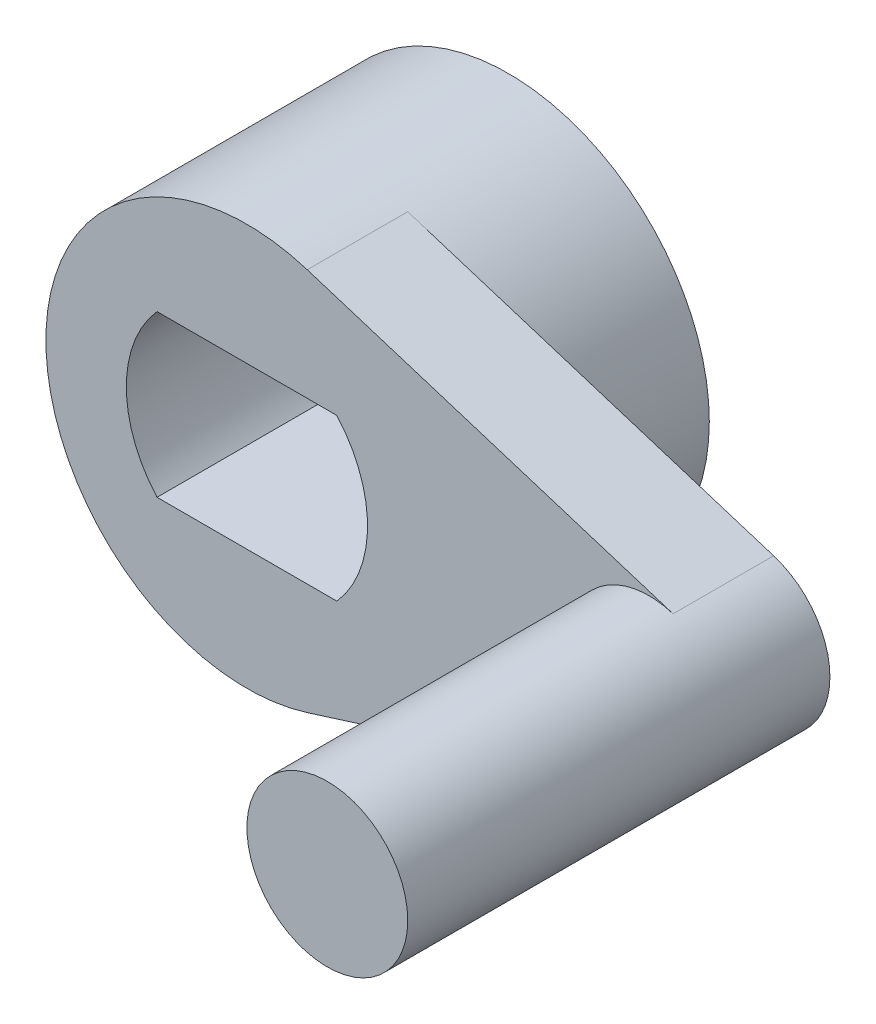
SolidWorks part; units mm, degrees
ref_plane "Face" through (0, 0, 0) normal (0, 0, 1) x (1, 0, 0)
ref_plane "Dessus" through (0, 0, 0) normal (0, 1, 0) x (1, 0, 0)
ref_plane "Droite" through (0, 0, 0) normal (1, 0, 0) x (0, 0, -1)
sketch "Esquisse1" plane through (0, 0, 0) normal (0, 0, 1) x (1, 0, 0)
  circle A0 centre (0, 0) radius 5
  dimension "D1" = 10
extrude "Extrusion1" add sketch "Esquisse1" along normal blind 6.5
sketch "Esquisse2" plane through (0, 0, 6.5) normal (0, 0, 1) x (1, 0, 0)
  line L0 (0, 0) -> (8.148, 0) construction
  line L1 (1.5, 4.7697) -> (10.6, 1.9079)
  line L2 (1.5, -4.7697) -> (10.6, -1.9079)
  arc A0 (10.6, -1.9079) -> (10.6, 1.9079) centre (10, 0) ccw
  arc A1 (1.5, 4.7697) -> (1.5, -4.7697) centre (0, 0) ccw
  dimension "D1" = 4
  dimension "D3" = 5
  dimension "D2" = 10
extrude "Extrusion2" add sketch "Esquisse2" against normal blind 2.5
sketch "Esquisse3" plane through (0, 0, 6.5) normal (0, 0, 1) x (1, 0, 0)
  circle A0 centre (10, 0) radius 2
  dimension "D1" = 4
extrude "Extrusion3" add sketch "Esquisse3" along normal blind 8
sketch "Esquisse4" plane through (0, 0, 6.5) normal (0, 0, 1) x (1, 0, 0)
  line L0 (-2.2361, 2) -> (2.2361, 2)
  line L1 (-2.2361, -2) -> (2.2361, -2)
  arc A0 (-2.2361, 2) -> (-2.2361, -2) centre (0, 0) ccw
  arc A1 (2.2361, -2) -> (2.2361, 2) centre (0, 0) ccw
  dimension "D1" = 6
  dimension "D2" = 4
  dimension "D3" = 2
extrude "Enlèv. mat.-Extru.1" cut sketch "Esquisse4" against normal through all
sketch "Esquisse5" plane through (0, 0, 6.5) normal (0, 0, 1) x (1, 0, 0)
  line L0 (0, 0) -> (13.7245, 0) construction
sketch "Esquisse6" plane through (0, 0, 14.5) normal (0, 0, 1) x (1, 0, 0)
  point P0 (10, 0)
